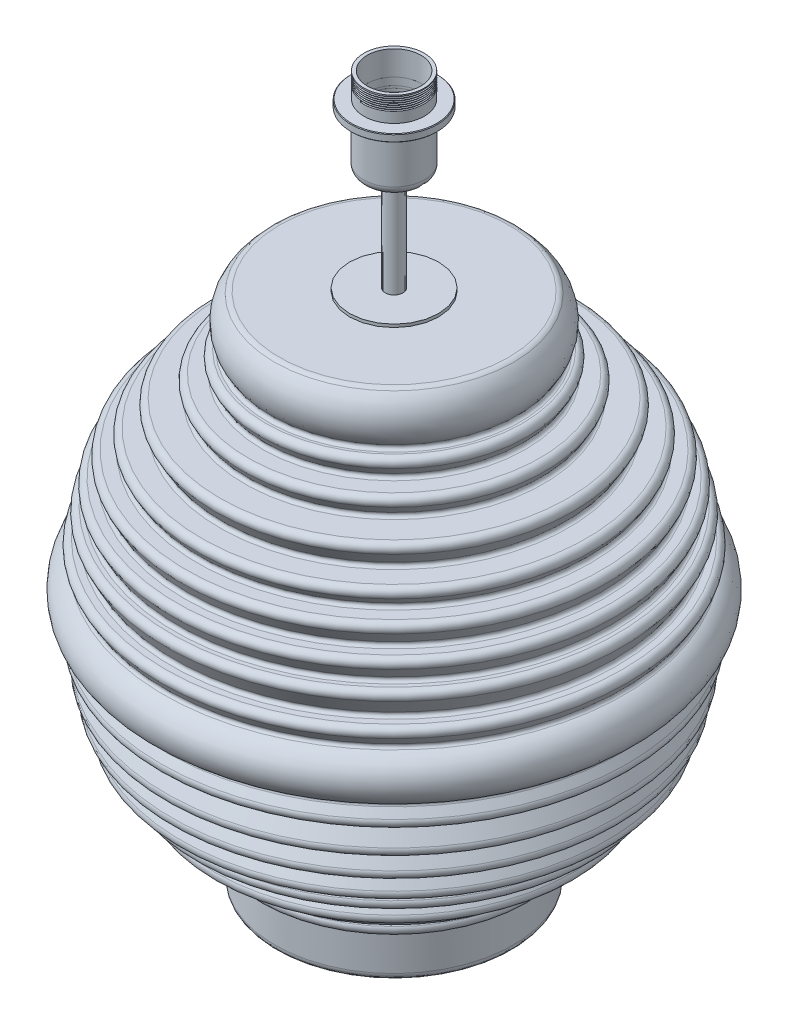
SolidWorks part; units mm, degrees
ref_plane "Alzado" through (0, 0, 0) normal (0, 0, 1) x (1, 0, 0)
ref_plane "Planta" through (0, 0, 0) normal (0, 1, 0) x (1, 0, 0)
ref_plane "Vista lateral" through (0, 0, 0) normal (1, 0, 0) x (0, 0, -1)
ref_plane "Plano3" through (0, 355, 0) normal (0, 1, 0) x (1, 0, 0)
sketch "Croquis2" plane through (0, 355, 0) normal (0, 1, 0) x (1, 0, 0)
  circle A0 centre (0, 0) radius 30
extrude "Saliente-Extruir2" add sketch "Croquis2" along normal blind 2
sketch "Croquis3" plane through (0, 357, 0) normal (0, 1, 0) x (1, 0, 0)
  circle A0 centre (0, 0) radius 6
extrude "Saliente-Extruir3" add sketch "Croquis3" along normal blind 67.15
sketch "Croquis4" plane through (0, 0, 0) normal (0, 0, 1) x (1, 0, 0)
  line L4 (0, 0) -> (0, 338.8915)
sketch "Croquis5" plane through (0, 424.15, 0) normal (0, 1, 0) x (1, 0, 0)
  circle A0 centre (0, 0) radius 20.5
  dimension "D1" = 41
extrude "Saliente-Extruir4" add sketch "Croquis5" along normal blind 34.4 separate body
fillet "Redondeo2" radius 6 1 edges at (0, 424.15, 20.5)
sketch "Croquis6" plane through (0, 458.55, 0) normal (0, 1, 0) x (1, 0, 0)
  circle A0 centre (0, 0) radius 22.25
  dimension "D1" = 44.5
extrude "Saliente-Extruir5" add sketch "Croquis6" along normal blind 1.95 contours A0
sketch "Croquis7" plane through (0, 460.5, 0) normal (0, 1, 0) x (1, 0, 0)
  circle A0 centre (0, 0) radius 20.5
extrude "Saliente-Extruir6" add sketch "Croquis7" along normal blind 1.5
sketch "Croquis9" plane through (0, 462, 0) normal (0, 1, 0) x (1, 0, 0)
  circle A0 centre (0, 0) radius 29
extrude "Saliente-Extruir7" add sketch "Croquis9" along normal blind 5
chamfer "Chaflán1" distance 0.42 angle 45 2 edges at (0, 462, 29) (0, 467, 29)
sketch "Croquis10" plane through (0, 467, 0) normal (0, 1, 0) x (1, 0, 0)
  circle A0 centre (0, 0) radius 20.3
extrude "Saliente-Extruir8" add sketch "Croquis10" along normal blind 16.46
thread "Rosca1" pitch 1.25 start angle 0, offset 0, length 8.46, pitch 1.25, diameter 40.6
ref_plane "Plano1" through (-20.3, 483.46, 0) normal (0, 0, 1) x (-1, 0, 0)
sketch "Perfil de rosca1" plane through (-20.3, 483.46, 0) normal (0, 0, 1) x (-1, 0, 0)
  line L0 (0, 0) -> (0, 1.25) construction
  line L11 (0, 0) -> (0, 1.0937)
  line L12 (0, 1.0937) -> (-0.6766, 0.7031)
  line L13 (-0.6766, 0.7031) -> (-0.6766, 0.3906)
  line L15 (-0.6766, 0.3906) -> (0, 0)
  line L17 (-0.6766, 0.5469) -> (0, 0.5469) construction
  point P2 (0, 0)
  dimension "Pitch" = 1.25
  dimension "Profile_Angle" = 60
  dimension "Profile_Land" = 0.3125
  dimension "Profile_Height" = 0.6766
sketch "Croquis13" plane through (0, 424.15, 0) normal (0, -1, 0) x (1, 0, 0)
  line L0 (-17, 0) -> (17, 0)
  circle A0 centre (17, 0) radius 3
  circle A1 centre (-17, 0) radius 3
  point P4 (0, 0)
  dimension "D1" = 34
extrude "Cortar-Extruir1" cut sketch "Croquis13" against normal blind 8 contours A0 | A1
sketch "Croquis14" plane through (0, 483.46, 0) normal (0, 1, 0) x (1, 0, 0)
  circle A0 centre (0, 0) radius 18
extrude "Cortar-Extruir2" cut sketch "Croquis14" against normal blind 46
sketch "Croquis31" plane through (0, 0, 0) normal (0, 0, 1) x (1, 0, 0)
  line L0 (-0.4026, 48.8088) -> (-0.4026, 353.8088) construction
  line L1 (-2.4001, 355) -> (0, 61.44)
  line L3 (0, 50) -> (-93.9652, 50)
  line L4 (-99.5652, 61.44) -> (0, 61.44)
  line L6 (-2.4001, 355) -> (-61.4799, 355)
  line L7 (0, 50) -> (0, 61.44)
  spline S0 degree 2 poles (-93.9652, 50) (-101.1229, 53.4375) (-99.5652, 61.44) knots 0 0 0 1 1 1
  spline S1 degree 3 poles (-99.5652, 61.44) (-102.1544, 65.7871) (-117.3736, 65.7334) (-128.7317, 99.957) (-145.9174, 146.6119) (-148.6679, 207.9051) (-144.2787, 253.1903) (-131.8415, 270.2538) (-108.9478, 278.3836) (-69.67, 280.1988) (-56.0132, 319.4362) (-60.6344, 340.9538) (-71.1838, 343.72) (-70.5533, 350.2232) (-69.0957, 351.749) (-68.8247, 351.9799) knots 0 0 0 0 0.03334 0.089678 0.220122 0.404061 0.512348 0.530824 0.547378 0.68043 0.773066 0.800524 0.8224 0.834718 0.83722 0.83722 0.83722 0.83722
  spline S2 degree 2 poles (-61.4799, 355) (-66.2793, 354.988) (-69.5535, 351.2026) knots 0 0 0 1 1 1
  spline S3 degree 3 poles (-49.6095, 355) (-43.7501, 355.1583) (-37.8871, 355.1022) (-32.0234, 355) knots 0.883377 0.883377 0.883377 0.883377 0.924719 0.924719 0.924719 0.924719
  dimension "D1" = 305
sketch "Croquis41" plane through (0, 0, 0) normal (0, 0, 1) x (1, 0, 0)
  line L0 (-2.7029, 9.8776) -> (-2.7029, 354.8776) construction
  line L1 (0, 355) -> (0, 9.2575)
  line L2 (-30, 355) -> (30, 355) construction
  line L3 (0, 9.2575) -> (-75.12, 9.2575)
  line L4 (-80.12, 14.2575) -> (-80.12, 40.3487)
  line L5 (-82.12, 42.3487) -> (-86.3296, 42.3487)
  line L6 (-89.7473, 48.427) -> (-86.7265, 53.3944)
  line L7 (-88.4354, 56.4336) -> (-98.3208, 56.4336)
  line L8 (-101.7385, 62.5119) -> (-98.6515, 67.5883)
  line L9 (-100.3604, 70.6274) -> (-116.9689, 70.6274)
  line L10 (-120.3866, 76.7058) -> (-115.4835, 84.7687)
  line L11 (-117.1924, 87.8078) -> (-129.3576, 87.8078)
  line L12 (-132.7753, 93.8862) -> (-130.3506, 97.8734)
  line L13 (-132.0595, 100.9126) -> (-139.7965, 100.9126)
  line L14 (-143.2904, 106.8601) -> (-139.2117, 114.1773)
  line L15 (-140.9586, 117.1511) -> (-146.0196, 117.1511)
  line L16 (-149.5135, 123.0986) -> (-145.5569, 130.1967)
  line L17 (-147.3038, 133.1704) -> (-149.8263, 133.1704)
  line L18 (-153.3202, 139.118) -> (-147.721, 149.1628)
  line L19 (-149.468, 152.1366) -> (-153.4734, 152.1366)
  line L20 (-156.8911, 158.2149) -> (-153.7394, 163.3976)
  line L21 (0, 355) -> (-77.0742, 355)
  line L22 (-156.8911, 205.3001) -> (-153.7394, 200.1174)
  line L23 (-149.468, 211.3785) -> (-153.4734, 211.3785)
  line L24 (-153.3202, 224.3971) -> (-147.721, 214.3522)
  line L25 (-147.3038, 230.3446) -> (-149.8263, 230.3446)
  line L26 (-149.5135, 240.4164) -> (-145.5569, 233.3184)
  line L27 (-140.9586, 246.364) -> (-146.0196, 246.364)
  line L28 (-143.2904, 256.6549) -> (-139.2117, 249.3377)
  line L29 (-132.0595, 262.6025) -> (-139.7965, 262.6025)
  line L30 (-132.7753, 269.6289) -> (-130.3506, 265.6416)
  line L31 (-117.1924, 275.7072) -> (-129.3576, 275.7072)
  line L32 (-120.3866, 286.8093) -> (-115.4835, 278.7464)
  line L33 (-100.3604, 292.8876) -> (-116.9689, 292.8876)
  line L34 (-101.7385, 301.0031) -> (-98.6515, 295.9268)
  line L35 (-88.4354, 307.0815) -> (-98.3208, 307.0815)
  line L36 (-89.7473, 315.0881) -> (-86.7265, 310.1206)
  line L37 (-84.7854, 321.1664) -> (-86.3296, 321.1664)
  arc A0 (-154.7033, 197.2222) -> (-154.7033, 166.2929) centre (-148.4958, 181.7575) ccw
  arc A1 (-75.12, 9.2575) -> (-80.12, 14.2575) centre (-75.12, 14.2575) cw
  arc A2 (-88.4354, 307.0815) -> (-86.7265, 310.1206) centre (-88.4354, 309.0815) ccw
  arc A3 (-100.3604, 292.8876) -> (-98.6515, 295.9268) centre (-100.3604, 294.8876) ccw
  arc A4 (-117.1924, 275.7072) -> (-115.4835, 278.7464) centre (-117.1924, 277.7072) ccw
  arc A5 (-132.0595, 262.6025) -> (-130.3506, 265.6416) centre (-132.0595, 264.6025) ccw
  arc A6 (-140.9586, 246.364) -> (-139.2117, 249.3377) centre (-140.9586, 248.364) ccw
  arc A7 (-147.3038, 230.3446) -> (-145.5569, 233.3184) centre (-147.3038, 232.3446) ccw
  arc A8 (-149.468, 211.3785) -> (-147.721, 214.3522) centre (-149.468, 213.3785) ccw
  arc A9 (-154.7033, 197.2222) -> (-153.7394, 200.1174) centre (-155.4483, 199.0783) ccw
  arc A10 (-153.7394, 163.3976) -> (-154.7033, 166.2929) centre (-155.4483, 164.4368) ccw
  arc A11 (-147.721, 149.1628) -> (-149.468, 152.1366) centre (-149.468, 150.1366) ccw
  arc A12 (-145.5569, 130.1967) -> (-147.3038, 133.1704) centre (-147.3038, 131.1704) ccw
  arc A13 (-139.2117, 114.1773) -> (-140.9586, 117.1511) centre (-140.9586, 115.1511) ccw
  arc A14 (-130.3506, 97.8734) -> (-132.0595, 100.9126) centre (-132.0595, 98.9126) ccw
  arc A15 (-115.4835, 84.7687) -> (-117.1924, 87.8078) centre (-117.1924, 85.8078) ccw
  arc A16 (-98.6515, 67.5883) -> (-100.3604, 70.6274) centre (-100.3604, 68.6274) ccw
  arc A17 (-86.7265, 53.3944) -> (-88.4354, 56.4336) centre (-88.4354, 54.4336) ccw
  arc A18 (-80.12, 40.3487) -> (-82.12, 42.3487) centre (-82.12, 40.3487) ccw
  arc A19 (-80.3671, 353.7626) -> (-83.2045, 324.3915) centre (-66.1966, 337.571) ccw
  arc A20 (-84.7854, 321.1664) -> (-83.2045, 324.3915) centre (-84.7854, 323.1664) ccw
  arc A21 (-77.0742, 355) -> (-80.3671, 353.7626) centre (-77.0742, 350) ccw
  arc A22 (-89.7473, 315.0881) -> (-86.3296, 321.1664) centre (-86.3296, 317.1664) cw
  arc A23 (-101.7385, 301.0031) -> (-98.3208, 307.0815) centre (-98.3208, 303.0815) cw
  arc A24 (-120.3866, 286.8093) -> (-116.9689, 292.8876) centre (-116.9689, 288.8876) cw
  arc A25 (-132.7753, 269.6289) -> (-129.3576, 275.7072) centre (-129.3576, 271.7072) cw
  arc A26 (-143.2904, 256.6549) -> (-139.7965, 262.6025) centre (-139.7965, 258.6025) cw
  arc A27 (-149.5135, 240.4164) -> (-146.0196, 246.364) centre (-146.0196, 242.364) cw
  arc A28 (-153.3202, 224.3971) -> (-149.8263, 230.3446) centre (-149.8263, 226.3446) cw
  arc A29 (-156.8911, 205.3001) -> (-153.4734, 211.3785) centre (-153.4734, 207.3785) cw
  arc A30 (-153.4734, 152.1366) -> (-156.8911, 158.2149) centre (-153.4734, 156.1366) cw
  arc A31 (-149.8263, 133.1704) -> (-153.3202, 139.118) centre (-149.8263, 137.1704) cw
  arc A32 (-146.0196, 117.1511) -> (-149.5135, 123.0986) centre (-146.0196, 121.1511) cw
  arc A33 (-139.7965, 100.9126) -> (-143.2904, 106.8601) centre (-139.7965, 104.9126) cw
  arc A34 (-129.3576, 87.8078) -> (-132.7753, 93.8862) centre (-129.3576, 91.8078) cw
  arc A35 (-116.9689, 70.6274) -> (-120.3866, 76.7058) centre (-116.9689, 74.6274) cw
  arc A36 (-98.3208, 56.4336) -> (-101.7385, 62.5119) centre (-98.3208, 60.4336) cw
  arc A37 (-86.3296, 42.3487) -> (-89.7473, 48.427) centre (-86.3296, 46.3487) cw
  dimension "D2" = 5
  dimension "D3" = 2
  dimension "D4" = 2
  dimension "D5" = 5
  dimension "D6" = 4
  dimension "D1" = 345
revolve "Revolución5" add sketch "Croquis41" angle 360 about L1
